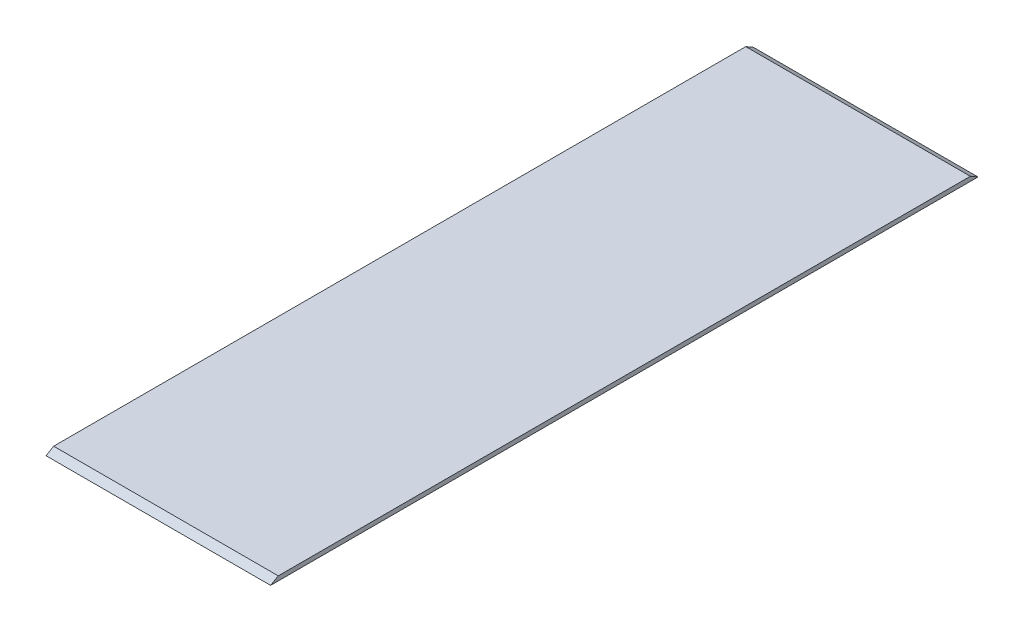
SolidWorks part; units mm, degrees
ref_plane "Front Plane" through (0, 0, 0) normal (0, 0, 1) x (1, 0, 0)
ref_plane "Top Plane" through (0, 0, 0) normal (0, 1, 0) x (1, 0, 0)
ref_plane "Right Plane" through (0, 0, 0) normal (1, 0, 0) x (0, 0, -1)
sketch "Sketch1" plane through (0, 0, 0) normal (0, 1, 0) x (1, 0, 0)
  line L1 (-322.58, -1016) -> (322.58, -1016)
  line L2 (-322.58, -1016) -> (-322.58, 1016)
  line L3 (-322.58, 1016) -> (322.58, 1016)
  line L4 (322.58, -1016) -> (322.58, 1016)
  line L5 (-322.58, -1016) -> (322.58, 1016) construction
  line L6 (-322.58, 1016) -> (322.58, -1016) construction
  point P0 (0, 0)
  dimension "D1" = 2032
  dimension "D2" = 645.16
extrude "Extrude1" add sketch "Sketch1" along normal mid plane 12.7
sketch "Sketch2" plane through (322.58, 0, 0) normal (1, 0, 0) x (0, 0, -1)
  line L0 (-1016, -6.35) -> (-994.003, 6.35)
  line L1 (994.003, 6.35) -> (1016, -6.35)
  line L4 (-1016, -6.35) -> (1016, -6.35)
  line L5 (1016, -6.35) -> (1016, 6.35)
  line L6 (1016, 6.35) -> (-1016, 6.35)
  line L7 (-1016, 6.35) -> (-1016, -6.35)
  line L8 (-1016, -6.35) -> (1016, -6.35)
  line L9 (1016, -6.35) -> (1016, 6.35)
  line L10 (1016, 6.35) -> (-1016, 6.35)
  line L11 (-1016, 6.35) -> (-1016, -6.35)
  dimension "D2" = 60
  dimension "D3" = 60
  dimension "D1" = 0
extrude "Extrude2" cut sketch "Sketch2" against normal through all contours L0 M8 M7 | L1 M7 M6
